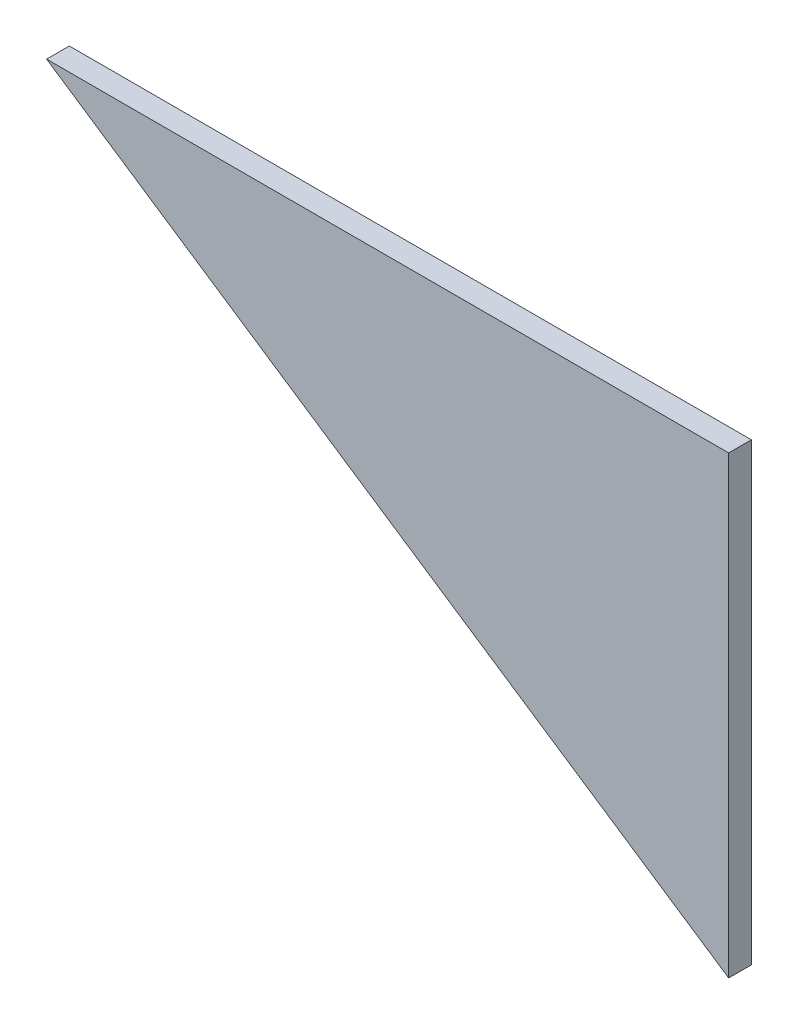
SolidWorks part; units mm, degrees
ref_plane "Piano frontale" through (0, 0, 0) normal (0, 0, 1) x (1, 0, 0)
ref_plane "Piano superiore" through (0, 0, 0) normal (0, 1, 0) x (1, 0, 0)
ref_plane "Piano destro" through (0, 0, 0) normal (1, 0, 0) x (0, 0, -1)
sketch "Schizzo1" plane through (0, 0, 0) normal (0, 0, 1) x (1, 0, 0)
  line L0 (0, 0) -> (-150, 100)
  line L1 (-150, 100) -> (0, 100)
  line L2 (0, 100) -> (0, 0)
  dimension "D1" = 150
  dimension "D2" = 100
extrude "Estrusione-Estrusione1" add sketch "Schizzo1" along normal blind 5
ref_plane "Piano1" through (0, 0, 2.5) normal (0, 0, 1) x (1, 0, 0)
